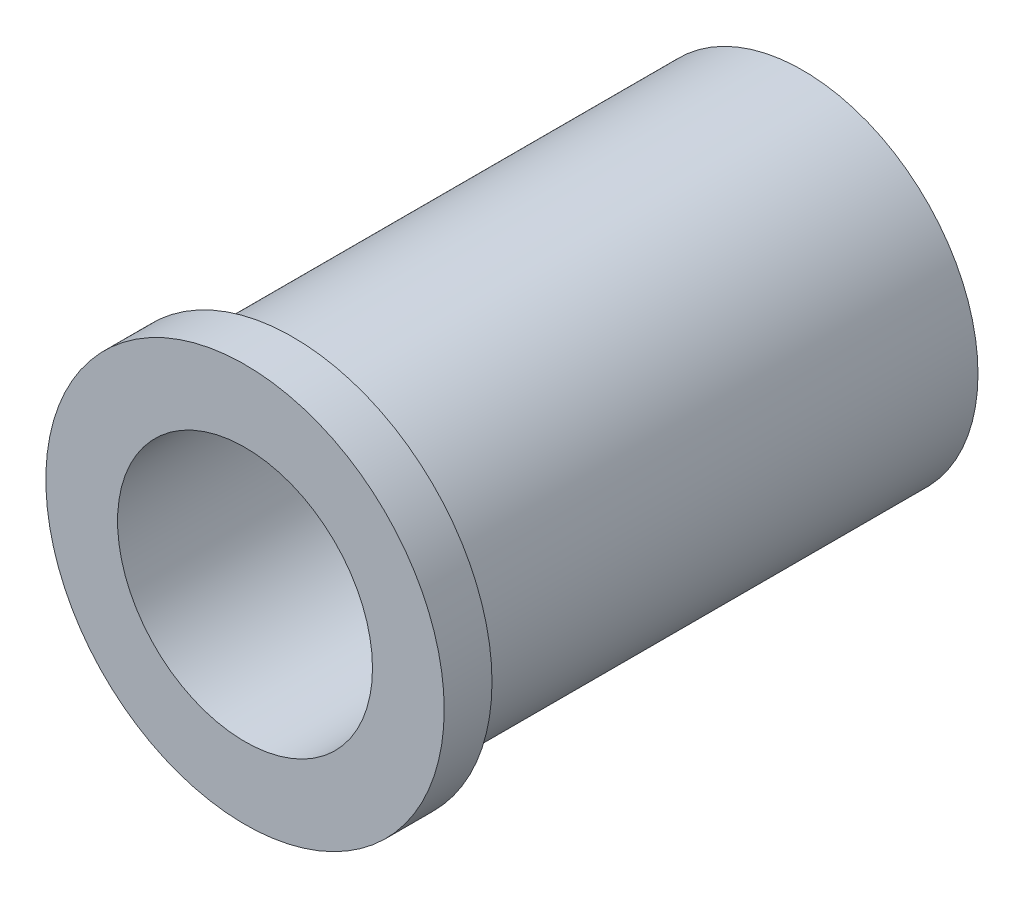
SolidWorks part; units mm, degrees
ref_plane "前视基准面" through (0, 0, 0) normal (0, 0, 1) x (1, 0, 0)
ref_plane "上视基准面" through (0, 0, 0) normal (0, 1, 0) x (1, 0, 0)
ref_plane "右视基准面" through (0, 0, 0) normal (1, 0, 0) x (0, 0, -1)
sketch "草图1" plane through (0, 0, 0) normal (0, 0, 1) x (1, 0, 0)
  circle A0 centre (0, 0) radius 11
extrude "凸台-拉伸1" add sketch "草图1" along normal blind 32
sketch "草图2" plane through (0, 0, 32) normal (0, 0, 1) x (1, 0, 0)
  circle A0 centre (0, 0) radius 12.5
extrude "凸台-拉伸2" add sketch "草图2" along normal blind 3
sketch "草图3" plane through (0, 0, 35) normal (0, 0, 1) x (1, 0, 0)
  circle A0 centre (0, 0) radius 8
extrude "切除-拉伸1" cut sketch "草图3" against normal through all
